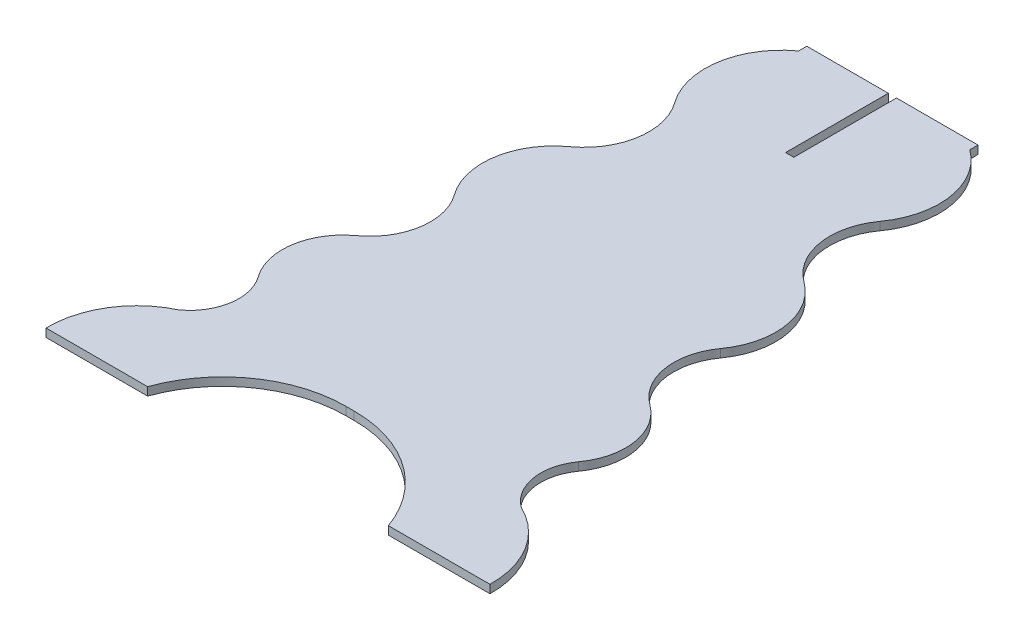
SolidWorks part; units mm, degrees
ref_plane "Front Plane" through (0, 0, 0) normal (0, 0, 1) x (1, 0, 0)
ref_plane "Top Plane" through (0, 0, 0) normal (0, 1, 0) x (1, 0, 0)
ref_plane "Right Plane" through (0, 0, 0) normal (1, 0, 0) x (0, 0, -1)
sketch "Sketch1" plane through (0, 0, 0) normal (0, 1, 0) x (1, 0, 0)
  line L1 (0, 0) -> (0, 780) construction
  line L2 (250, 0) -> (250, -240) construction
  line L4 (125, 780) -> (250, 0) construction
  line L5 (6, 0) -> (6, 642)
  line L6 (125, 780) -> (125, 792)
  line L7 (125, 792) -> (-125, 792)
  line L8 (-125, 780) -> (-125, 792)
  line L9 (6, 642) -> (-6, 642)
  line L10 (-6, 0) -> (-6, 642)
  line L11 (250, -240) -> (-250, -240) construction
  line L12 (324.1909, -120) -> (175.8091, -120)
  line L14 (-324.1909, -120) -> (-175.8091, -120)
  arc A0 (-125, 780) -> (-149.9935, 624.0406) centre (-59.5171, 689.5236) ccw
  arc A1 (-149.9935, 624.0406) -> (-171.2041, 491.6862) centre (-226.776, 568.4687) cw
  arc A2 (-171.2041, 491.6862) -> (-194.4407, 346.69) centre (-110.3243, 407.5698) ccw
  arc A3 (-194.4407, 346.69) -> (-214.1603, 223.6394) centre (-265.8258, 295.0245) cw
  arc A4 (-214.1603, 223.6394) -> (-234.0009, 99.8344) centre (-162.1781, 151.8166) ccw
  arc A5 (-234.0009, 99.8344) -> (-250, 0) centre (-291.9176, 57.9167) cw
  arc A6 (234.0009, 99.8344) -> (250, 0) centre (291.9176, 57.9167) ccw
  arc A7 (214.1603, 223.6394) -> (234.0009, 99.8344) centre (162.1781, 151.8166) cw
  arc A8 (194.4407, 346.69) -> (214.1603, 223.6394) centre (265.8258, 295.0245) ccw
  arc A9 (171.2041, 491.6862) -> (194.4407, 346.69) centre (110.3243, 407.5698) cw
  arc A10 (149.9935, 624.0406) -> (171.2041, 491.6862) centre (226.776, 568.4687) ccw
  arc A11 (125, 780) -> (149.9935, 624.0406) centre (59.5171, 689.5236) cw
  arc A12 (250, 0) -> (324.1909, -120) centre (193.9976, -117.5585) cw
  arc A13 (175.8091, -120) -> (6, 0) centre (6, -180.1463) ccw
  arc A14 (-175.8091, -120) -> (-6, 0) centre (-6, -180.1463) cw
  arc A15 (-250, 0) -> (-324.1909, -120) centre (-193.9976, -117.5585) ccw
  point P4 (0, 0)
  point P8 (0, 780)
  point P42 (250, -120)
  dimension "D1" = 500
  dimension "D2" = 780
  dimension "D3" = 250
  dimension "D4" = 12
  dimension "D5" = 6
  dimension "D6" = 12
  dimension "D7" = 150
  dimension "D8" = 120
extrude "Boss-Extrude1" add sketch "Sketch1" along normal blind 12
sketch "Sketch2" plane through (0, 12, 0) normal (0, 1, 0) x (1, 0, 0)
  line L0 (6, 642) -> (6, 0) construction
  line L1 (-6, 642) -> (6, 642)
  line L2 (-6, 642) -> (-6, 0)
  line L3 (-6, 0) -> (6, 0)
  line L4 (6, 642) -> (6, 0)
  arc A0 (175.8091, -120) -> (6, 0) centre (6, -180.1463) ccw construction
extrude "Boss-Extrude3" add sketch "Sketch2" against normal blind 12
sketch "Sketch3" plane through (0, 12, 0) normal (0, 1, 0) x (1, 0, 0)
  line L0 (0, 0) -> (0, 792) construction
  line L1 (125, 792) -> (-125, 792) construction
  line L3 (-6, 792) -> (6, 792)
  line L4 (-6, 792) -> (-6, 642)
  line L5 (-6, 642) -> (6, 642)
  line L6 (6, 792) -> (6, 642)
  dimension "D1" = 6
  dimension "D2" = 12
  dimension "D3" = 150
extrude "Cut-Extrude1" cut sketch "Sketch3" against normal blind 12
